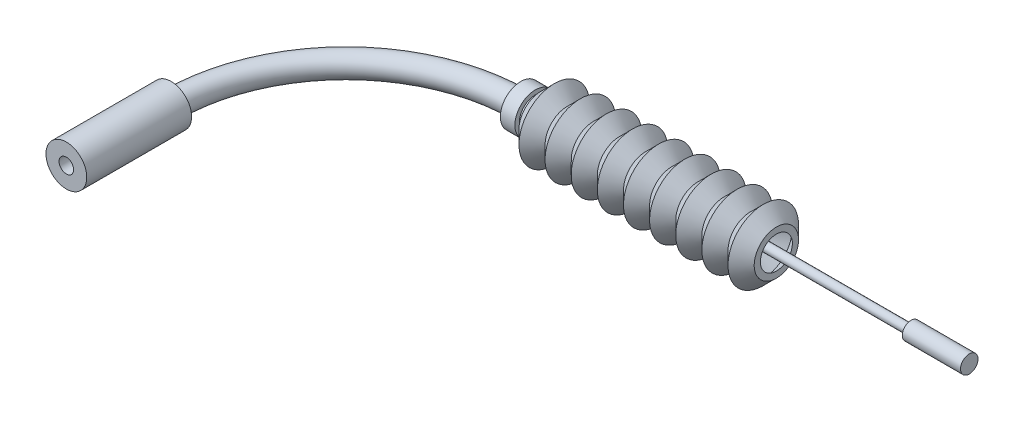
SolidWorks part; units mm, degrees
ref_plane "Piano frontale" through (0, 0, 0) normal (0, 0, 1) x (1, 0, 0)
ref_plane "Piano superiore" through (0, 0, 0) normal (0, 1, 0) x (1, 0, 0)
ref_plane "Piano destro" through (0, 0, 0) normal (1, 0, 0) x (0, 0, -1)
sketch "Schizzo1" plane through (0, 0, 0) normal (0, 1, 0) x (1, 0, 0)
  line L0 (-64.5823, 0) -> (0, 0) construction
  line L1 (0, 0) -> (0, 69.6512) construction
  arc A0 (0, 30) -> (-30, 0) centre (0, 0) ccw
  dimension "D1" = 60
sketch "Schizzo2" plane through (0, 0, 0) normal (0, 0, 1) x (1, 0, 0)
  circle A0 centre (-30, 0) radius 2
  circle A1 centre (-30, 0) radius 1.25
  dimension "D1" = 4
  dimension "D2" = 0.75
sweep "Sweep1" add profiles "Schizzo2" path "Schizzo1"
sketch "Schizzo3" plane through (0, 0, 0) normal (0, 0, 1) x (1, 0, 0)
  circle A0 centre (-30, 0) radius 1.25 construction
  circle A1 centre (-30, 0) radius 1.25
  circle A2 centre (-30, 0) radius 3.5
  dimension "D1" = 7
extrude "Estrusione1" add sketch "Schizzo3" along normal blind 18
sketch "Schizzo4" plane through (0, 0, 0) normal (1, 0, 0) x (0, 0, -1)
  circle A0 centre (30, 0) radius 1.25 construction
  circle A1 centre (30, 0) radius 1.25
  circle A2 centre (30, 0) radius 3.5
  dimension "D1" = 7
extrude "Estrusione2" add sketch "Schizzo4" along normal blind 2.5
sketch "Schizzo5" plane through (2.5, 0, 0) normal (1, 0, 0) x (0, 0, -1)
  circle A0 centre (30, 0) radius 1.25 construction
  circle A1 centre (30, 0) radius 1.25
  circle A2 centre (30, 0) radius 2.75
  dimension "D1" = 5.5
extrude "Estrusione3" add sketch "Schizzo5" along normal blind 4.5
ref_plane "Piano1" through (0, 0, -30) normal (0, 0, 1) x (1, 0, 0)
ref_axis "Asse1" through (7, 0, -30) along (-1, 0, 0)
sketch "Schizzo7" plane through (0, 0, -30) normal (0, 0, 1) x (1, 0, 0)
  line L0 (3.5, 2.75) -> (5.75, 4.9927)
  line L1 (5.75, 4.9927) -> (8, 2.75)
  line L2 (8, 2.75) -> (10.2355, 4.9927)
  line L3 (10.2355, 4.9927) -> (12.4855, 2.75)
  line L4 (12.4855, 2.75) -> (14.7209, 4.9927)
  line L5 (14.7209, 4.9927) -> (16.9709, 2.75)
  line L6 (16.9709, 2.75) -> (19.2064, 4.9927)
  line L7 (19.2064, 4.9927) -> (21.4564, 2.75)
  line L8 (21.4564, 2.75) -> (23.6918, 4.9927)
  line L9 (23.6918, 4.9927) -> (25.9435, 2.7483)
  line L10 (3.5, 3.8089) -> (5.75, 6.0517)
  line L11 (5.75, 6.0517) -> (7.9983, 3.8107)
  line L12 (7.9983, 3.8107) -> (10.2337, 6.0534)
  line L13 (10.2337, 6.0534) -> (12.4837, 3.8107)
  line L14 (12.4837, 3.8107) -> (14.7192, 6.0534)
  line L15 (14.7192, 6.0534) -> (16.9692, 3.8107)
  line L16 (16.9692, 3.8107) -> (19.2046, 6.0534)
  line L17 (19.2046, 6.0534) -> (21.4546, 3.8107)
  line L18 (21.4546, 3.8107) -> (23.6901, 6.0534)
  line L19 (23.6901, 6.0534) -> (25.9418, 3.8089)
  line L20 (3.5, 2.75) -> (3.5, 3.8089)
  line L21 (32.6644, 4.991) -> (34.9144, 2.7483)
  line L22 (34.9144, 2.7483) -> (37.1499, 4.991)
  line L23 (25.9435, 2.7483) -> (28.179, 4.991)
  line L24 (2.5, 2.75) -> (3.5, 2.75) construction
  line L25 (7, 2.75) -> (2.5, 2.75) construction
  line L26 (37.1499, 4.991) -> (39.4016, 2.7466)
  line L27 (25.9418, 3.8089) -> (28.1773, 6.0517)
  line L28 (30.4273, 3.8089) -> (32.6627, 6.0517)
  line L29 (30.429, 2.7483) -> (32.6644, 4.991)
  line L30 (28.179, 4.991) -> (30.429, 2.7483)
  line L31 (28.1773, 6.0517) -> (30.4273, 3.8089)
  line L32 (37.1482, 6.0517) -> (39.3999, 3.8072)
  line L33 (32.6627, 6.0517) -> (34.9127, 3.8089)
  line L34 (34.9127, 3.8089) -> (37.1482, 6.0517)
  line L36 (39.4016, 2.7466) -> (41.6371, 4.9893)
  line L37 (41.6371, 4.9893) -> (43.8871, 2.7466)
  line L38 (41.6354, 6.0499) -> (43.8871, 3.8055)
  line L39 (39.3999, 3.8072) -> (41.6354, 6.0499)
  line L40 (43.8871, 3.8055) -> (43.8871, 2.7466)
revolve "Rivoluzione1" add sketch "Schizzo7" angle 360 about axis through (7, 0, -30) along (-1, 0, 0)
sketch "Schizzo8" plane through (7, 0, 0) normal (1, 0, 0) x (0, 0, -1)
  circle A0 centre (30, 0) radius 0.75
  dimension "D1" = 1.5
extrude "Estrusione4" add sketch "Schizzo8" along normal blind 70
sketch "Schizzo9" plane through (77, 0, 0) normal (1, 0, 0) x (0, 0, -1)
  circle A0 centre (30, 0) radius 1.5
  dimension "D1" = 3
extrude "Estrusione5" add sketch "Schizzo9" against normal blind 10
